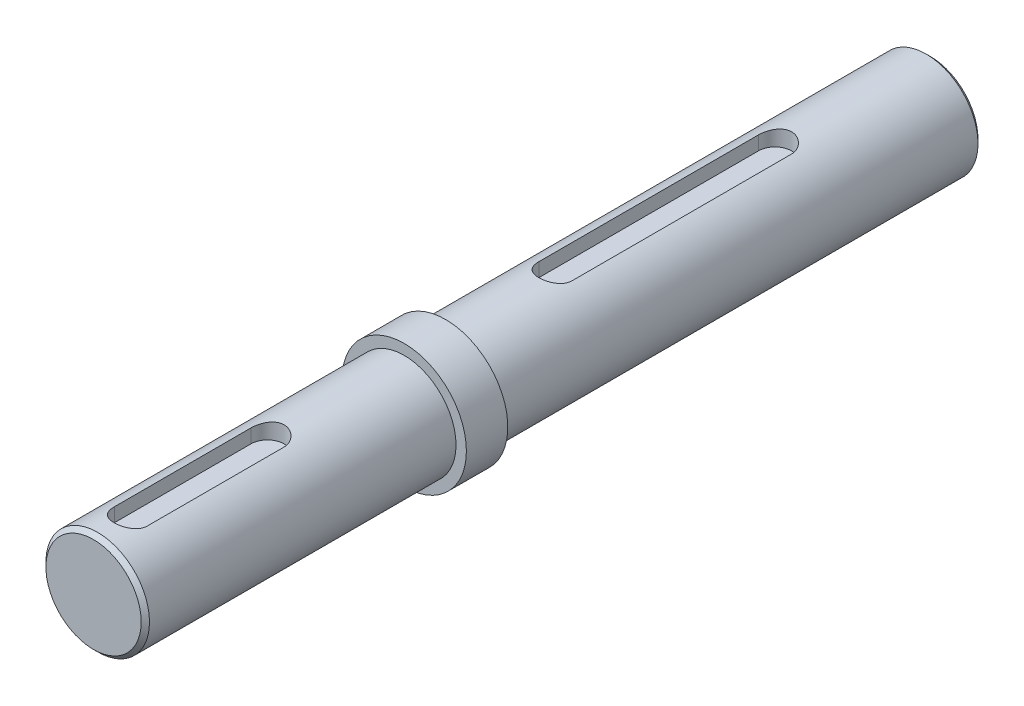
SolidWorks part; units mm, degrees
ref_plane "Plan de face" through (0, 0, 0) normal (0, 0, 1) x (1, 0, 0)
ref_plane "Plan de dessus" through (0, 0, 0) normal (0, 1, 0) x (1, 0, 0)
ref_plane "Plan de droite" through (0, 0, 0) normal (1, 0, 0) x (0, 0, -1)
sketch "Esquisse1" plane through (0, 0, 0) normal (0, 0, 1) x (1, 0, 0)
  circle A0 centre (0, 0) radius 15
  dimension "D1" = 30
extrude "Extrusion1" add sketch "Esquisse1" along normal blind 202
sketch "Esquisse2" plane through (0, 0, 202) normal (0, 0, 1) x (1, 0, 0)
  circle A0 centre (0, 0) radius 12.5
  dimension "D1" = 25
extrude "Enlèv. mat.-Extru.1" cut sketch "Esquisse2" against normal blind 75 flip side to cut
sketch "Esquisse3" plane through (0, 0, 0) normal (0, 0, -1) x (-1, 0, 0)
  circle A0 centre (0, 0) radius 12.5
  dimension "D1" = 25
extrude "Enlèv. mat.-Extru.2" cut sketch "Esquisse3" against normal blind 117 flip side to cut
sketch "Esquisse21" plane through (-5.9206, -23.9381, 202) normal (0, 0, 1) x (1, 0, 0)
  line L0 (5.9206, 33.4381) -> (5.9206, 36.4381)
  line L1 (5.9206, 36.4381) -> (15.9206, 36.4381)
  circle A0 centre (5.9206, 23.9381) radius 12.5 construction
  dimension "D1" = 3
  dimension "D2" = 10
ref_plane "Plan1" through (0, 12.5, 202) normal (0, 1, 0) x (1, 0, 0)
sketch "Esquisse11" plane through (0, 12.5, 202) normal (0, 1, 0) x (-1, 0, 0)
  line L0 (-4, -9) -> (-4, -42)
  line L1 (4, -42) -> (4, -9)
  line L6 (12.5, 0) -> (-12.5, 0) construction
  arc A0 (-4, -42) -> (4, -42) centre (0, -42) ccw
  arc A1 (4, -9) -> (-4, -9) centre (0, -9) ccw
  dimension "D1" = 41
  dimension "D3" = 5
  dimension "D2" = 8
extrude "Enlèv. mat.-Extru.21" cut sketch "Esquisse11" against normal blind 4
other "rainure clavette <1>"
sketch "Esquisse22" plane through (-0.0117, -25.0869, 0) normal (0, 0, -1) x (-1, 0, 0)
  line L0 (-0.0117, 34.5869) -> (-0.0117, 37.5869)
  line L1 (-0.0117, 37.5869) -> (9.9883, 37.5869)
  circle A0 centre (-0.0117, 25.0869) radius 12.5 construction
  dimension "D1" = 3
  dimension "D2" = 10
ref_plane "Plan11" through (0, 12.5, 0) normal (0, 1, 0) x (1, 0, 0)
sketch "Esquisse12" plane through (0, 12.5, 0) normal (0, 1, 0) x (1, 0, 0)
  line L0 (-4, -37.5) -> (-4, -90.5)
  line L1 (4, -90.5) -> (4, -37.5)
  line L4 (12.5, 0) -> (-12.5, 0) construction
  arc A0 (-4, -90.5) -> (4, -90.5) centre (0, -90.5) ccw
  arc A1 (4, -37.5) -> (-4, -37.5) centre (0, -37.5) ccw
  dimension "D1" = 61
  dimension "D3" = 33.5
  dimension "D2" = 8
extrude "Enlèv. mat.-Extru.22" cut sketch "Esquisse12" against normal blind 4
other "rainure clavette <2>"
chamfer "Chanfrein1" distance 1 angle 45 2 edges at (-12.5, 0, 0) (12.5, 0, 202)
hole_wizard "Trou taraudé M8x1.251" positions "Esquisse24" profile "Esquisse23" tap size "M8x1.25" standard "ISO"
sketch "Esquisse24" plane through (0, 0, 0) normal (0, 0, -1) x (-1, 0, 0)
  circle A0 centre (0, 0) radius 11.5 construction
  point P0 (0, 0)
sketch "Esquisse23" plane through (0, 0, 0) normal (1, 0, 0) x (0, 1, 0)
  line L0 (0, 0) -> (0, 22.0429)
  line L1 (0, 22.0429) -> (3.4, 20)
  line L2 (3.4, 20) -> (3.4, 0)
  line L5 (3.4, 0) -> (0, 0)
  line L10 (0, 22.0429) -> (-3.4, 20) construction
  line L11 (0, -6.35) -> (0, 107.95) construction
  dimension "Diamètre du trou pour taraudage" = 6.8
  dimension "Profondeur du trou pour taraudage" = 20
  dimension "Angle de pointe" = 118
